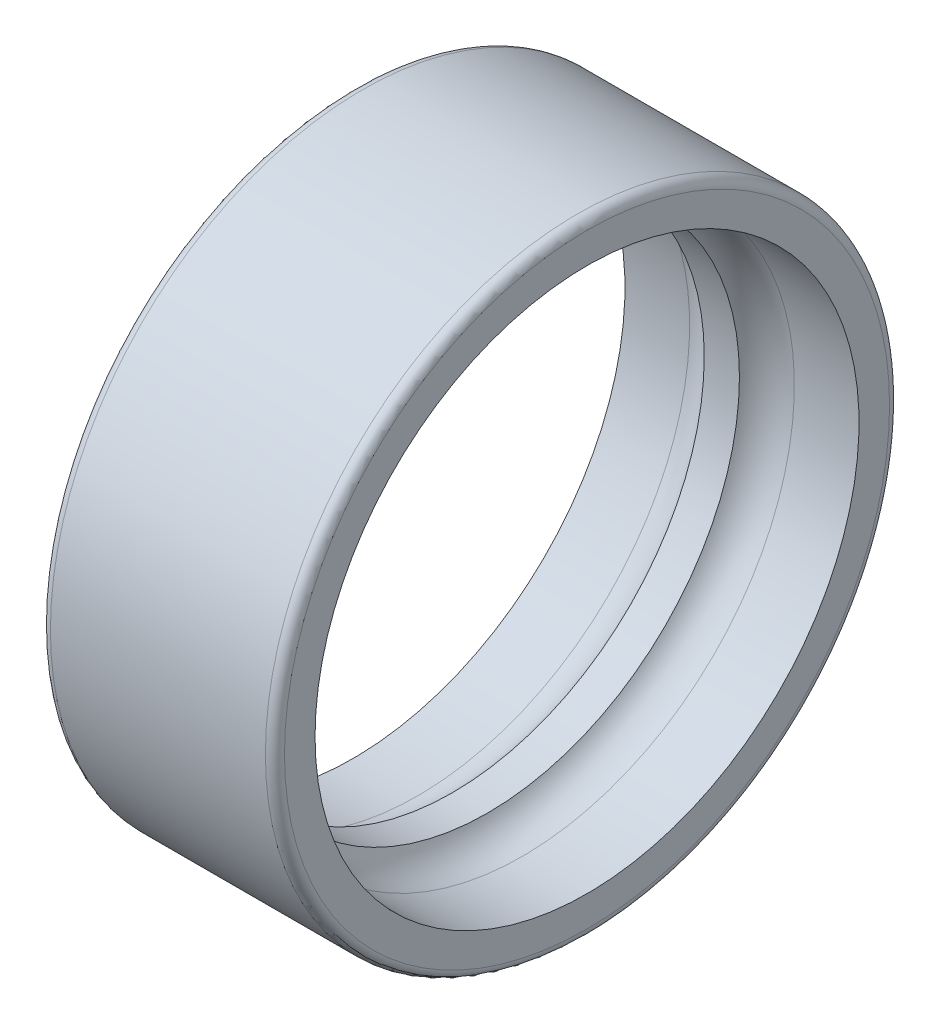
SolidWorks part; units mm, degrees
ref_plane "Plan de face" through (0, 0, 0) normal (0, 0, 1) x (1, 0, 0)
ref_plane "Plan de dessus" through (0, 0, 0) normal (0, 1, 0) x (1, 0, 0)
ref_plane "Plan de droite" through (0, 0, 0) normal (1, 0, 0) x (0, 0, -1)
sketch "Esquisse1" plane through (0, 0, 0) normal (0, 0, 1) x (1, 0, 0)
  line L0 (0, 36) -> (0, 17.5) construction
  line L1 (-12.4, 36) -> (12.4, 36)
  line L2 (-13.5, 34.9) -> (-13.5, 18.6) construction
  line L3 (-12.4, 17.5) -> (12.4, 17.5) construction
  line L4 (13.5, 34.9) -> (13.5, 18.6) construction
  line L5 (13.5, 29.05) -> (2.0291, 29.05) construction
  line L6 (13.5, 24.45) -> (-13.5, 24.45) construction
  line L7 (-13.5, 26.75) -> (13.5, 26.75) construction
  line L8 (-6.0417, 17.5) -> (-6.0417, 36) construction
  line L9 (0, 0) -> (13.5, 0) construction
  line L10 (13.5, 34.9) -> (13.5, 31.375)
  line L11 (-13.5, 34.9) -> (-13.5, 31.375)
  line L12 (2.0291, 29.05) -> (-2.0291, 29.05)
  line L13 (-2.0291, 29.05) -> (-13.5, 29.05) construction
  line L14 (-6.0417, 31.375) -> (-13.5, 31.375)
  line L15 (6.0417, 31.375) -> (13.5, 31.375)
  arc A1 (-13.5, 18.6) -> (-12.4, 17.5) centre (-12.4, 18.6) ccw construction
  arc A2 (-12.4, 36) -> (-13.5, 34.9) centre (-12.4, 34.9) ccw
  arc A3 (13.5, 34.9) -> (12.4, 36) centre (12.4, 34.9) ccw
  arc A4 (12.4, 17.5) -> (13.5, 18.6) centre (12.4, 18.6) ccw construction
  arc A6 (-2.0291, 29.05) -> (-6.0417, 31.375) centre (-6.0417, 26.75) ccw
  arc A7 (2.0291, 29.05) -> (6.0417, 31.375) centre (6.0417, 26.75) cw
  arc A8 (-10.6667, 26.75) -> (-1.4167, 26.75) centre (-6.0417, 26.75) ccw construction
  dimension "D4" = 1.1
  dimension "D5" = 7.4583
  dimension "D8" = 9.25
  dimension "D1" = 17.5
  dimension "D2" = 36
  dimension "D3" = 27
  dimension "D6" = 24.45
  dimension "D7" = 29.05
revolve "Révolution1" add sketch "Esquisse1" angle 360 about L9
equation "\"D5@Esquisse1\"=(\"D3@Esquisse1\"-2*\"D8@Esquisse1\")/3+\"D8@Esquisse1\"/2"
